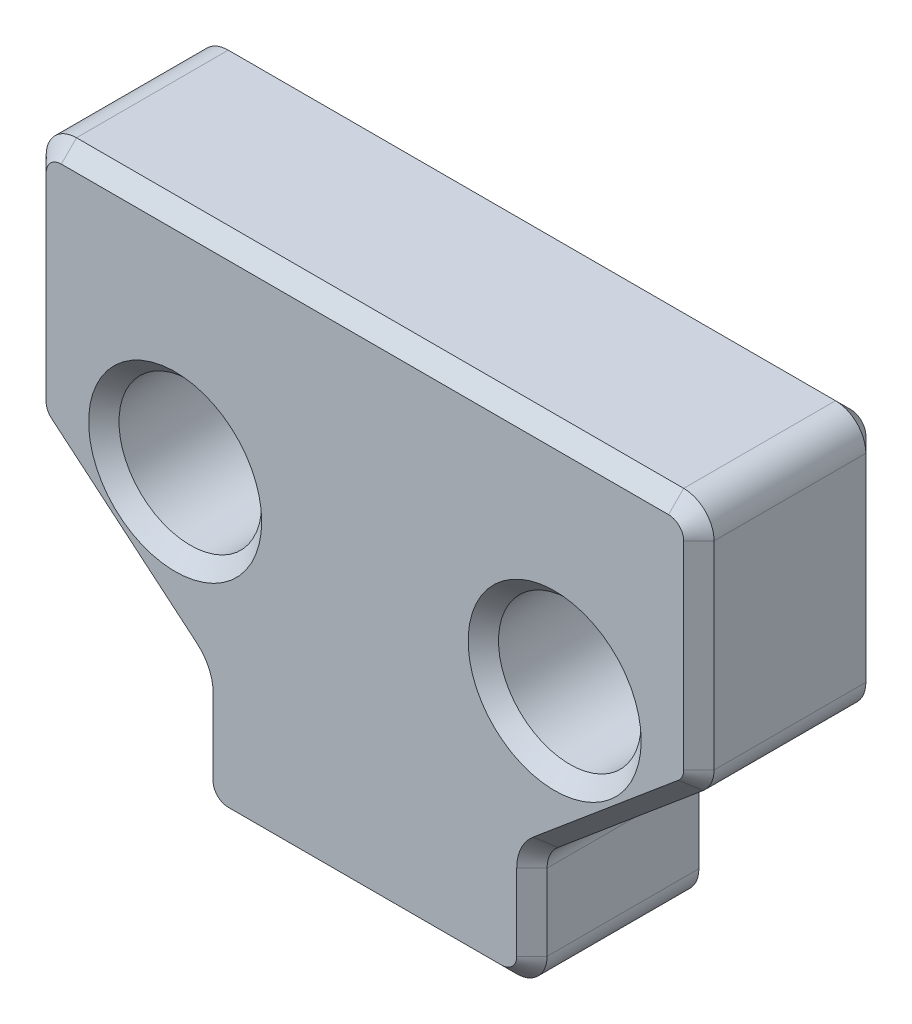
SolidWorks part; units mm, degrees
ref_plane "Płaszczyzna przednia" through (0, 0, 0) normal (0, 0, 1) x (1, 0, 0)
ref_plane "Płaszczyzna górna" through (0, 0, 0) normal (0, 1, 0) x (1, 0, 0)
ref_plane "Płaszczyzna prawa" through (0, 0, 0) normal (1, 0, 0) x (0, 0, -1)
sketch "Szkic1" plane through (0, 0, 0) normal (0, 0, 1) x (1, 0, 0)
  line L0 (0, 0) -> (0, 3.985)
  line L1 (0, 3.985) -> (-5.5, 8.6)
  line L2 (-5.5, 8.6) -> (-5.5, 16.6)
  line L3 (-5.5, 16.6) -> (16.5, 16.6)
  line L4 (0, 0) -> (11, 0)
  line L5 (5.5, 16.6) -> (5.5, 0) construction
  line L6 (16.5, 8.6) -> (16.5, 16.6)
  line L7 (11, 3.985) -> (16.5, 8.6)
  line L8 (11, 0) -> (11, 3.985)
  dimension "D1" = 16.6
  dimension "D2" = 11
  dimension "D3" = 22
  dimension "D4" = 130
  dimension "D5" = 8
extrude "Dodanie-wyciągnięcie1" add sketch "Szkic1" along normal blind 6
sketch "Szkic2" plane through (0, 0, 6) normal (0, 0, 1) x (1, 0, 0)
  line L0 (-0.75, 9.2) -> (11.75, 9.2) construction
  line L1 (16.5, 16.6) -> (-5.5, 16.6) construction
  circle A0 centre (-0.75, 9.2) radius 1.7
  circle A1 centre (11.75, 9.2) radius 1.7
  point P2 (5.5, 9.2)
  point P5 (5.5, 16.6)
  dimension "D3" = 3.4
  dimension "D1" = 7.4
  dimension "D2" = 12.5
extrude "Wytnij-wyciągnięcie1" cut sketch "Szkic2" against normal through all
fillet "Zaokrąglenie1" radius 1 8 edges at (-5.5, 8.6, 3) (0, 3.985, 3) (0, 0, 3) (11, 0, 3) (11, 3.985, 3) (16.5, 8.6, 3) (-5.5, 16.6, 3) (16.5, 16.6, 3)
hole_wizard "Otwór Ø4.7 (4.7)2" positions "Szkic6" profile "Szkic7" hole size "Ø4.7" standard "DIN"
sketch "Szkic6" plane through (0, 0, 6) normal (0, 0, 1) x (1, 0, 0)
  point P0 (-0.75, 9.2)
  point P3 (11.75, 9.2)
sketch "Szkic7" plane through (-0.75, 9.2, 6) normal (1, 0, 0) x (0, -1, 0)
  line L0 (0, 0) -> (0, 6.412)
  line L1 (0, 6.412) -> (2.35, 5)
  line L2 (2.35, 5) -> (2.35, 0)
  line L5 (2.35, 0) -> (0, 0)
  line L10 (0, 6.412) -> (-2.35, 5) construction
  line L11 (0, -6.35) -> (0, 107.95) construction
  dimension "Średnica otworu" = 4.7
  dimension "Głębokość otworu" = 5
  dimension "Kąt wiertła" = 118
chamfer "Sfazowanie1" distance 0.5 angle 45 34 edges at (-5.2071, 16.3071, 6) (5.5, 16.6, 6) (16.2071, 16.3071, 6) (16.5, 12.3332, 6) (16.4063, 8.6437, 6) (13.75, 6.2925, 6) (11.0937, 3.9413, 6) (11, 2.2593, 6) (10.7071, 0.2929, 6) (5.5, 0, 6) (0.2929, 0.2929, 6) (0, 2.2593, 6) (-0.0937, 3.9413, 6) (-2.75, 6.2925, 6) (-5.4063, 8.6437, 6) (-5.5, 12.3332, 6) (14.1, 9.2, 6) (1.6, 9.2, 6) (11, 2.2593, 0) (11.0937, 3.9413, 0) (10.7071, 0.2929, 0) (13.75, 6.2925, 0) (5.5, 0, 0) (16.4063, 8.6437, 0) (0.2929, 0.2929, 0) (16.5, 12.3332, 0) (0, 2.2593, 0) (16.2071, 16.3071, 0) (-0.0937, 3.9413, 0) (5.5, 16.6, 0) (-2.75, 6.2925, 0) (-5.2071, 16.3071, 0) (-5.4063, 8.6437, 0) (-5.5, 12.3332, 0)
